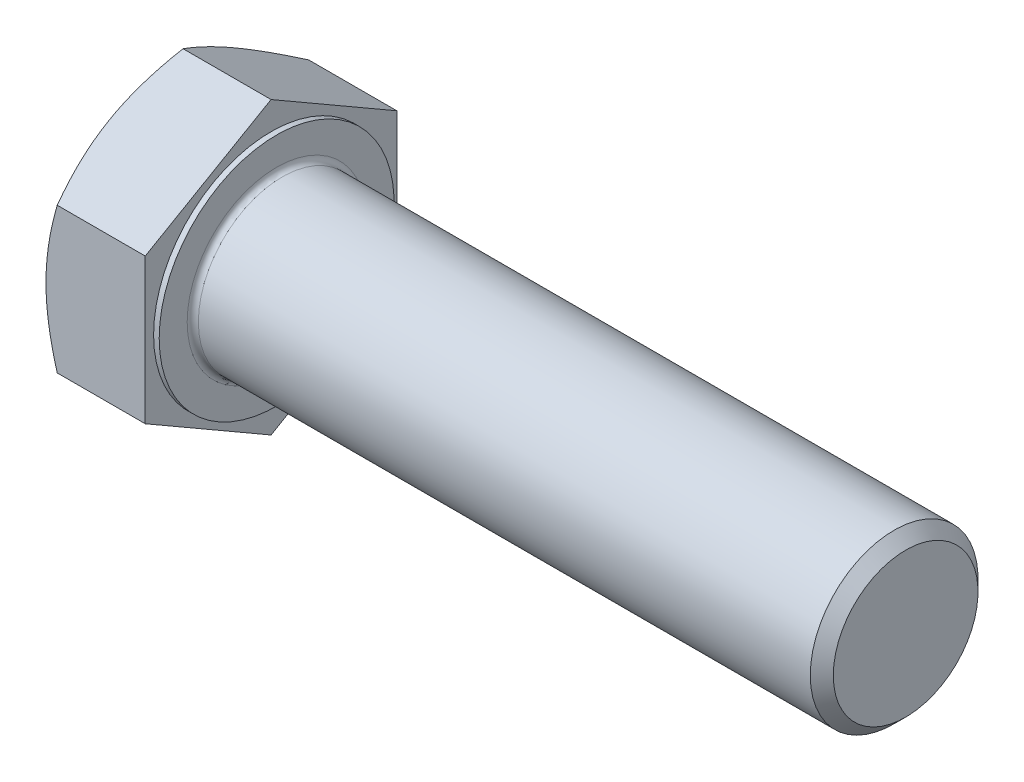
SolidWorks part; units mm, degrees
ref_plane "Front Plane" through (0, 0, 0) normal (0, 0, 1) x (1, 0, 0)
ref_plane "Top Plane" through (0, 0, 0) normal (0, 1, 0) x (1, 0, 0)
ref_plane "Right Plane" through (0, 0, 0) normal (1, 0, 0) x (0, 0, -1)
sketch "BaseHeadSke" plane through (0, 0, 0) normal (1, 0, 0) x (0, 0, -1)
  line L1 (18, 10.3923) -> (0, 20.7846)
  line L2 (0, 20.7846) -> (-18, 10.3923)
  line L3 (-18, 10.3923) -> (-18, -10.3923)
  line L4 (-18, -10.3923) -> (0, -20.7846)
  line L5 (0, -20.7846) -> (18, -10.3923)
  line L6 (18, -10.3923) -> (18, 10.3923)
  circle A0 centre (0, 0) radius 18 construction
  dimension "Width_flats" = 36
extrude "BaseHead" add sketch "BaseHeadSke" along normal blind 15
sketch "BodySke" plane through (0, 0, 0) normal (0, 0, 1) x (1, 0, 0)
  line L0 (0, 0) -> (105, 0)
  line L1 (105, 0) -> (105, 10.352)
  line L2 (105, 10.352) -> (103.352, 12)
  line L3 (103.352, 12) -> (0, 12)
  line L4 (0, 12) -> (0, 0)
  line L5 (15, 10.3923) -> (15, -10.3923) construction
  line L6 (0, 0) -> (159.3976, 0) construction
  line L7 (51, -84.3176) -> (51, 77.7215) construction
  line L8 (102, -21.5941) -> (102, 39.2994) construction
  dimension "Ang" = 45
  dimension "Length" = 90
  dimension "Diameter" = 24
  dimension "Minor_dia" = 20.704
  dimension "Thread_length" = 54
  dimension "Advance" = 3
revolve "BaseBody" add sketch "BodySke" angle 360 about L6
sketch "HeadChamferSke" plane through (0, 0, 0) normal (0, 0, 1) x (1, 0, 0)
  line L0 (1.6077, 20.7846) -> (0, 20.7846)
  line L1 (0, 20.7846) -> (0, 18)
  line L2 (0, 18) -> (1.6077, 20.7846)
  line L3 (0, 0) -> (120.9185, 0) construction
  dimension "D1" = 30
  dimension "Head_chamfer" = 36
revolve "HeadChamfer" cut sketch "HeadChamferSke" angle 360 about L3
sketch "BearingFaceSke" plane through (0, 0, 0) normal (0, 0, 1) x (1, 0, 0)
  line L0 (0, 0) -> (129.6443, 0) construction
  line L1 (14.2, 20.7846) -> (15, 20.7846)
  line L2 (14.2, 20.7846) -> (14.2, 16.805)
  line L3 (14.2, 16.805) -> (15, 16.805)
  line L4 (15, 20.7846) -> (15, 16.805)
  dimension "Bearing_height" = 0.8
  dimension "Dw" = 33.61
revolve "BearingFace" cut sketch "BearingFaceSke" angle 360 about L0
fillet "Fillet" radius 0.8 1 edges at (15, 0, 12)
sketch "ThdSchSke" plane through (0, 0, 0) normal (0, 0, 1) x (1, 0, 0)
  line L0 (101.0485, 13.9029) -> (101.0485, 12)
  line L1 (101.0485, 12) -> (102, 10.352)
  line L2 (102, 10.352) -> (102.9515, 12)
  line L3 (102.9515, 12) -> (102.9515, 13.9029)
  line L4 (102.9515, 13.9029) -> (101.0485, 13.9029)
  line L6 (0, 0) -> (141.9934, 0) construction
  line L7 (105, -10.352) -> (105, 10.352) construction
  dimension "D2" = 20.704
  dimension "D3" = 24
  dimension "Advance" = 3
revolve "ThreadSchematic" [suppressed] cut sketch "ThdSchSke" angle 360 about L6
pattern_linear "ThdSchPat" [suppressed] count 17 spacing 3 along (1, 0, 0)
equation "\"Thread_minor@ThreadCosmetic\" = \"Minor_dia@BodySke\""
equation "\"Thread_length@ThreadCosmetic\" = \"Thread_length@BodySke\""
equation "\"Head_chamfer@HeadChamferSke\" = \"Width_flats@BaseHeadSke\""
equation "\"D2@ThdSchSke\" = \"Minor_dia@BodySke\""
equation "\"D3@ThdSchSke\" = \"Diameter@BodySke\""
equation "\"Advance@ThdSchSke\" = \"Advance@BodySke\""
equation "\"D3@ThdSchPat\" = \"Advance@BodySke\""
equation "\"D1@ThdSchPat\" =  int( \"Thread_length@BodySke\"/\"Advance@BodySke\" )-1"
